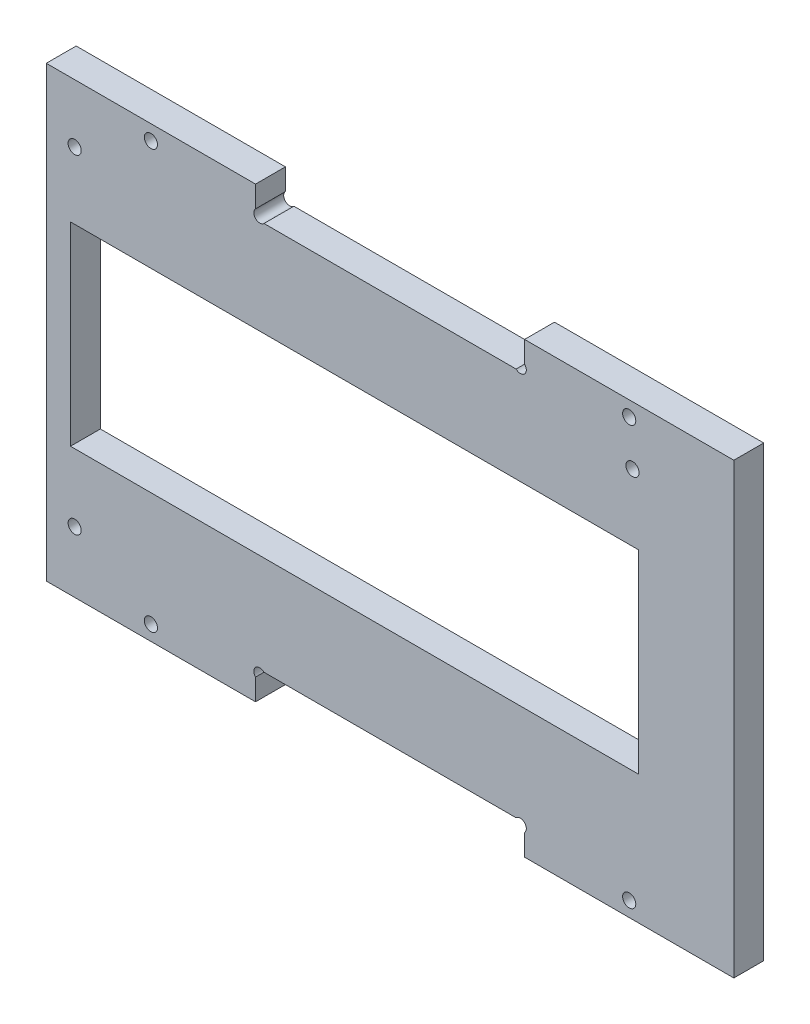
SolidWorks part; units mm, degrees
ref_plane "Plan de face" through (0, 0, 0) normal (0, 0, 1) x (1, 0, 0)
ref_plane "Plan de dessus" through (0, 0, 0) normal (0, 1, 0) x (1, 0, 0)
ref_plane "Plan de droite" through (0, 0, 0) normal (1, 0, 0) x (0, 0, -1)
sketch "Esquisse1" plane through (0, 0, 0) normal (0, 0, 1) x (1, 0, 0)
  line L1 (0, 0) -> (115, 0)
  line L2 (0, 0) -> (0, 75)
  line L3 (0, 75) -> (115, 75)
  line L4 (115, 0) -> (115, 75)
  dimension "D1" = 115
  dimension "D2" = 75
extrude "Boss.-Extru.1" add sketch "Esquisse1" along normal blind 5
sketch "Esquisse2" plane through (0, 0, 5) normal (0, 0, 1) x (1, 0, 0)
  line L0 (0, 75) -> (0, 0) construction
  line L1 (4.05, 21.55) -> (99.05, 21.55)
  line L2 (4.05, 21.55) -> (4.05, 54.05)
  line L3 (4.05, 54.05) -> (99.05, 54.05)
  line L4 (99.05, 21.55) -> (99.05, 54.05)
  line L5 (115, 75) -> (0, 75) construction
  dimension "D1" = 95
  dimension "D2" = 32.5
  dimension "D3" = 4.05
  dimension "D4" = 20.95
extrude "Enlèv. mat.-Extru.1" cut sketch "Esquisse2" against normal up to next
sketch "Esquisse3" plane through (0, 0, 5) normal (0, 0, 1) x (1, 0, 0)
  line L0 (0, 75) -> (0, 0) construction
  line L1 (115, 75) -> (0, 75) construction
  circle A0 centre (4.75, 65.25) radius 1.1
  circle A1 centre (98.05, 65.25) radius 1.1
  circle A2 centre (4.75, 10.25) radius 1.1
  dimension "D1" = 2.2
  dimension "D2" = 2.2
  dimension "D3" = 2.2
  dimension "D6" = 93.3
  dimension "D7" = 55
  dimension "D4" = 4.75
  dimension "D5" = 9.75
extrude "Enlèv. mat.-Extru.2" cut sketch "Esquisse3" against normal up to next
sketch "Esquisse4" plane through (0, 0, 5) normal (0, 0, 1) x (1, 0, 0)
  circle A0 centre (4.75, 65.25) radius 2
  circle A1 centre (98.05, 65.25) radius 2
  circle A2 centre (4.75, 10.25) radius 2
  dimension "D1" = 4
  dimension "D2" = 4
  dimension "D3" = 4
extrude "Enlèv. mat.-Extru.3" [suppressed] cut sketch "Esquisse4" against normal blind 1.5
sketch "Esquisse5" plane through (0, 0, 5) normal (0, 0, 1) x (1, 0, 0)
  line L0 (115, 75) -> (0, 75) construction
  line L1 (35, 75) -> (80, 75)
  line L2 (35, 75) -> (35, 70)
  line L3 (35, 70) -> (80, 70)
  line L4 (80, 75) -> (80, 70)
  line L5 (0, 0) -> (115, 0) construction
  line L6 (80, 0) -> (35, 0)
  line L7 (80, 0) -> (80, 5)
  line L8 (80, 5) -> (35, 5)
  line L9 (35, 0) -> (35, 5)
  line L10 (0, 75) -> (0, 0) construction
  dimension "D1" = 45
  dimension "D2" = 45
  dimension "D3" = 5
  dimension "D4" = 5
  dimension "D5" = 35
  dimension "D6" = 35
extrude "Enlèv. mat.-Extru.4" cut sketch "Esquisse5" against normal up to next
sketch "Esquisse6" plane through (0, 0, 5) normal (0, 0, 1) x (1, 0, 0)
  line L0 (35, 70) -> (51.871, 86.871) construction
  line L1 (80, 70) -> (63.4787, 86.5213) construction
  line L2 (80, 5) -> (62.7192, -12.2808) construction
  line L3 (35, 5) -> (51.052, -11.052) construction
  line L4 (35, 70) -> (80, 70) construction
  line L5 (80, 5) -> (35, 5) construction
  circle A0 centre (35.7071, 70.7071) radius 1
  circle A1 centre (79.2929, 70.7071) radius 1
  circle A2 centre (35.7071, 4.2929) radius 1
  circle A3 centre (79.2929, 4.2929) radius 1
  dimension "D5" = 2
  dimension "D6" = 2
  dimension "D7" = 2
  dimension "D8" = 2
  dimension "D1" = 45
  dimension "D2" = 45
  dimension "D3" = 45
  dimension "D4" = 45
extrude "Enlèv. mat.-Extru.5" cut sketch "Esquisse6" against normal up to next
sketch "Esquisse7" plane through (0, 0, 0) normal (0, 0, -1) x (-1, 0, 0)
  line L0 (-78.5858, 5) -> (-36.4142, 5) construction
  line L1 (-93.05, 13.5) -> (-53.05, 13.5)
  line L2 (-93.05, 13.5) -> (-93.05, 7.5)
  line L3 (-93.05, 7.5) -> (-53.05, 7.5)
  line L4 (-53.05, 13.5) -> (-53.05, 7.5)
  circle A0 centre (-98.05, 65.25) radius 1.1 construction
  dimension "D1" = 40
  dimension "D2" = 6
  dimension "D3" = 5
  dimension "D4" = 2.5
extrude "Enlèv. mat.-Extru.6" cut sketch "Esquisse7" against normal blind 1
ref_plane "Plan1" through (0, 37.5, 0) normal (0, 1, 0) x (-1, 0, 0)
ref_plane "Plan2" through (57.5, 0, 0) normal (-1, 0, 0) x (0, 0, 1)
sketch "Esquisse8" plane through (0, 0, 5) normal (0, 0, 1) x (1, 0, 0)
  line L0 (115, 75) -> (80, 75) construction
  line L1 (97.5, 75) -> (97.5, 68.1187) construction
  circle A0 centre (97.5, 72.5) radius 1.1
  dimension "D1" = 2.2
  dimension "D2" = 2.5
extrude "Enlèv. mat.-Extru.7" cut sketch "Esquisse8" against normal up to next
mirror "Symétrie1" about plane through (57.5, 0, 0) normal (-1, 0, 0) of "Enlèv. mat.-Extru.7"
mirror "Symétrie2" about plane through (0, 37.5, 0) normal (0, 1, 0) of "Symétrie1", "Enlèv. mat.-Extru.7"
